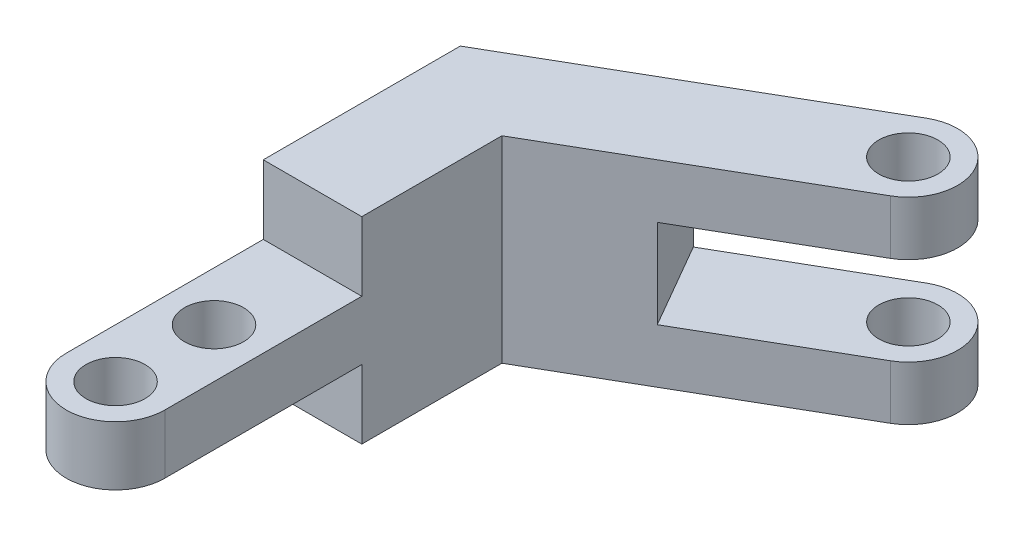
SolidWorks part; units mm, degrees
ref_plane "Front Plane" through (0, 0, 0) normal (0, 0, 1) x (1, 0, 0)
ref_plane "Top Plane" through (0, 0, 0) normal (0, 1, 0) x (1, 0, 0)
ref_plane "Right Plane" through (0, 0, 0) normal (1, 0, 0) x (0, 0, -1)
sketch "Sketch1" plane through (0, 0, 0) normal (0, 1, 0) x (1, 0, 0)
  line L6 (0, 0) -> (0, -20)
  line L11 (0, 0) -> (15, 8.6603)
  line L12 (5, -2.8868) -> (5, -20)
  line L13 (5, -2.8868) -> (17.5, 4.3301)
  line L14 (15, 8.6603) -> (17.5, 4.3301) construction
  line L15 (0, -20) -> (5, -20) construction
  circle A0 centre (16.25, 6.4952) radius 2.5
  circle A2 centre (2.5, -20) radius 2.5
  circle A3 centre (16.25, 6.4952) radius 1.5
  circle A4 centre (2.5, -20) radius 1.5
  circle A5 centre (2.5, -15) radius 1.5
  dimension "D5" = 3
  dimension "D6" = 3
  dimension "D1" = 20
  dimension "D2" = 120
  dimension "D3" = 15
  dimension "D4" = 5
  dimension "D7" = 2
extrude "Boss-Extrude1" add sketch "Sketch1" along normal blind 10 contours A2 L12 L13 A0 L11 L6 | A0 | A2
ref_plane "Plane1" through (0, 0, 0) normal (-0.5, 0, 0.866) x (0.866, 0, 0.5)
sketch "Sketch3" plane through (0, 0, 0) normal (-0.5, 0, -0.866) x (-0.866, 0, 0.5)
  line L0 (-8.6603, 10) -> (-8.6603, 0) construction
  line L1 (0, 10) -> (-17.3205, 10) construction
  line L2 (0, 0) -> (-17.3205, 0) construction
  line L3 (-17.3205, 5) -> (0, 5) construction
  line L4 (-17.3205, 10) -> (-17.3205, 0) construction
  line L6 (-25.9808, 2.75) -> (-8.6603, 2.75)
  line L7 (-25.9808, 2.75) -> (-25.9808, 7.25)
  line L8 (-25.9808, 7.25) -> (-8.6603, 7.25)
  line L9 (-8.6603, 2.75) -> (-8.6603, 7.25)
  line L10 (-25.9808, 2.75) -> (-8.6603, 7.25) construction
  line L11 (-25.9808, 7.25) -> (-8.6603, 2.75) construction
  dimension "D1" = 4.5
extrude "Cut-Extrude1" cut sketch "Sketch3" against normal up to surface (5 mm away)
sketch "Sketch5" plane through (0, 10, 0) normal (0, 1, 0) x (1, 0, 0)
  line L0 (0, -10) -> (5, -10) construction
  line L1 (0, 0) -> (0, -20) construction
  line L2 (5, -2.8868) -> (5, -20) construction
  line L4 (0, -10) -> (5, -10)
  line L5 (0, -10) -> (0, -23)
  line L6 (0, -23) -> (5, -23)
  line L7 (5, -10) -> (5, -23)
  dimension "D1" = 13
extrude "Cut-Extrude3" cut sketch "Sketch5" against normal blind 3.5
sketch "Sketch6" plane through (0, 0, 0) normal (0, -1, 0) x (1, 0, 0)
  line L0 (0, 10) -> (5, 10) construction
  line L1 (0, 0) -> (0, 20) construction
  line L3 (0, 10) -> (5, 10)
  line L4 (0, 10) -> (0, 23)
  line L5 (0, 23) -> (5, 23)
  line L6 (5, 10) -> (5, 23)
  dimension "D1" = 13
extrude "Cut-Extrude4" cut sketch "Sketch6" against normal blind 3.5
